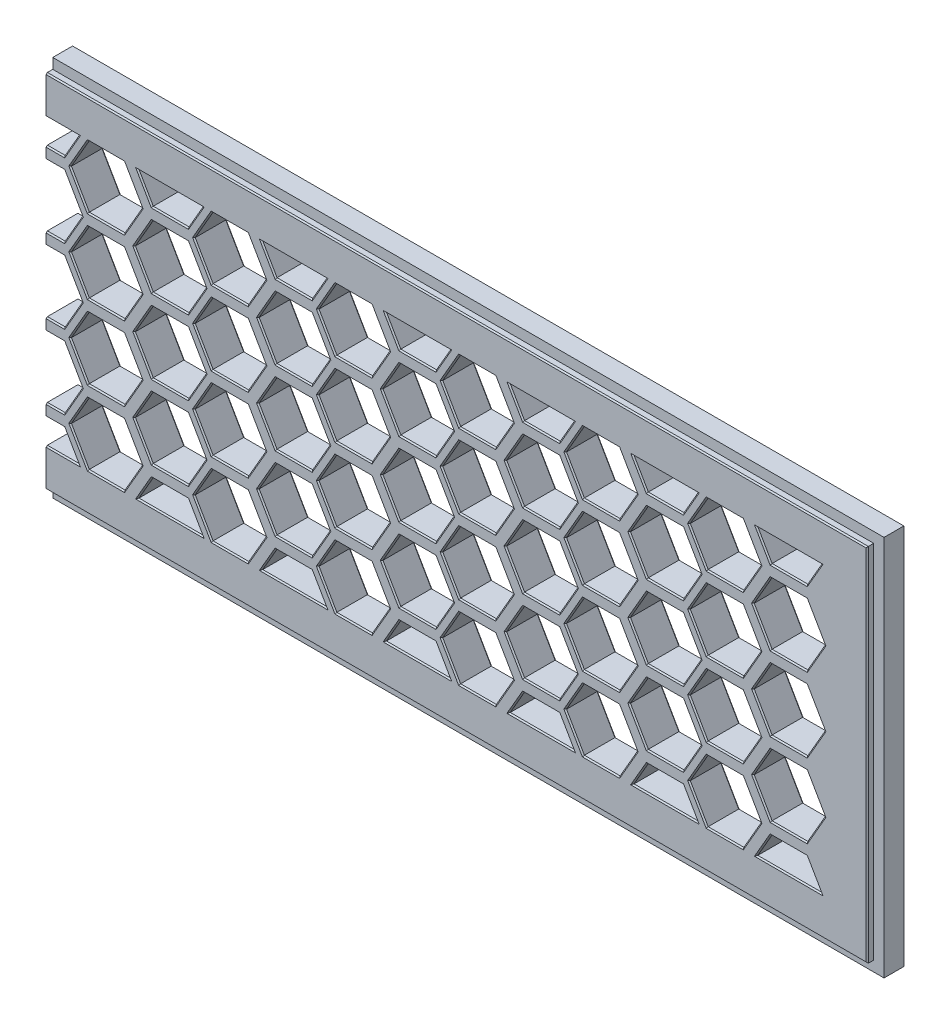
SolidWorks part; units mm, degrees
ref_plane "Aufriss" through (0, 0, 0) normal (0, 0, 1) x (1, 0, 0)
ref_plane "Grundriss" through (0, 0, 0) normal (0, 1, 0) x (1, 0, 0)
ref_plane "Seitenriss" through (0, 0, 0) normal (1, 0, 0) x (0, 0, -1)
sketch "Skizze1" plane through (0, 0, 0) normal (0, 0, 1) x (1, 0, 0)
  line L1 (-192, -43.75) -> (192, -43.75)
  line L2 (-192, -43.75) -> (-192, 43.75)
  line L3 (-192, 43.75) -> (192, 43.75)
  line L4 (192, -43.75) -> (192, 43.75)
  line L5 (-192, -43.75) -> (192, 43.75) construction
  line L6 (-192, 43.75) -> (192, -43.75) construction
  point P0 (0, 0)
  dimension "D1" = 384
  dimension "D2" = 87.5
extrude "Aufsatz-Linear austragen1" add sketch "Skizze1" along normal mid plane 8
sketch "Skizze2" plane through (0, 0, 4) normal (0, 0, 1) x (1, 0, 0)
  line L0 (-192, 43.75) -> (-192, -43.75) construction
  line L1 (-168.1699, 34.5) -> (-176.8301, 34.5)
  line L2 (-176.8301, 34.5) -> (-181.1603, 27)
  line L3 (-181.1603, 27) -> (-176.8301, 19.5)
  line L4 (-176.8301, 19.5) -> (-168.1699, 19.5)
  line L5 (-168.1699, 19.5) -> (-163.8397, 27)
  line L6 (-163.8397, 27) -> (-168.1699, 34.5)
  line L7 (192, 43.75) -> (-192, 43.75) construction
  circle A0 centre (-172.5, 27) radius 7.5 construction
  dimension "D1" = 19.5
  dimension "D2" = 16.75
  dimension "D3" = 15
extrude "Schnitt-Linear austragen1" cut sketch "Skizze2" against normal through all
pattern_linear "Lineares Muster1" count 12 spacing 30 along (1, 0, 0) count 4 spacing 18 along (0, -1, 0) of "Schnitt-Linear austragen1"
sketch "Skizze3" plane through (0, 0, 4) normal (0, 0, 1) x (1, 0, 0)
  line L0 (-168.1699, 34.5) -> (-176.8301, 34.5) construction
  line L1 (-161.3301, 25.5) -> (-165.6603, 18)
  line L2 (-165.6603, 18) -> (-161.3301, 10.5)
  line L3 (-161.3301, 10.5) -> (-152.6699, 10.5)
  line L4 (-152.6699, 10.5) -> (-148.3397, 18)
  line L5 (-148.3397, 18) -> (-152.6699, 25.5)
  line L6 (-152.6699, 25.5) -> (-161.3301, 25.5)
  line L7 (-192, 43.75) -> (-192, -43.75) construction
  line L8 (192, 43.75) -> (-192, 43.75) construction
  circle A0 centre (-157, 18) radius 7.5 construction
  dimension "D1" = 35
  dimension "D2" = 25.75
extrude "Schnitt-Linear austragen2" cut sketch "Skizze3" against normal through all
pattern_linear "Lineares Muster2" count 12 spacing 30 along (1, 0, 0) count 4 spacing 18 along (0, -1, 0) of "Schnitt-Linear austragen2"
pattern_linear "Lineares Muster3" count 2 spacing 18 along (0, 1, 0) count 25 spacing 30 along (1, 0, 0) of "Schnitt-Linear austragen2"
sketch "Skizze4" plane through (0, 0, 4) normal (0, 0, 1) x (1, 0, 0)
  line L0 (192, -43.75) -> (192, 43.75) construction
  line L1 (-192, 43.75) -> (192, 43.75)
  line L3 (-192, 34.5) -> (192, 34.5)
  line L4 (192, 43.75) -> (192, 34.5)
  line L5 (-192, 43.75) -> (-192, -43.75) construction
  line L6 (192, -43.75) -> (-192, -43.75)
  line L7 (192, -43.75) -> (192, -34.5)
  line L8 (192, -34.5) -> (-192, -34.5)
  line L9 (-192, -43.75) -> (-192, -34.5)
  line L11 (-176.8301, -34.5) -> (-168.1699, -34.5) construction
  line L12 (-168.1699, 34.5) -> (-176.8301, 34.5) construction
  line L14 (-192, 34.5) -> (-192, 43.75)
extrude "Aufsatz-Linear austragen2" add sketch "Skizze4" against normal up to surface (8 mm away)
sketch "Skizze5" plane through (0, 0, 0) normal (0, 0, 1) x (1, 0, 0)
  line L1 (-192, 43.75) -> (192, 43.75)
  line L2 (-192, 43.75) -> (-192, -43.75)
  line L3 (-192, -43.75) -> (192, -43.75)
  line L4 (192, 43.75) -> (192, -43.75)
  line L5 (-194.5, 46.25) -> (194.5, 46.25)
  line L6 (-194.5, 46.25) -> (-194.5, -46.25)
  line L7 (-194.5, -46.25) -> (194.5, -46.25)
  line L8 (194.5, 46.25) -> (194.5, -46.25)
  dimension "D1" = 2.5
  dimension "D2" = 2.5
  dimension "D3" = 2.5
  dimension "D4" = 2.5
extrude "Aufsatz-Linear austragen3" add sketch "Skizze5" along normal mid plane 4.8
sketch "Skizze6" plane through (0, 0, 4) normal (0, 0, 1) x (1, 0, 0)
  line L0 (194.5, 46.25) -> (-194.5, 46.25) construction
  line L1 (67.5, -46.25) -> (194.5, -46.25)
  line L2 (67.5, -46.25) -> (67.5, 46.25)
  line L3 (67.5, 46.25) -> (194.5, 46.25)
  line L4 (194.5, -46.25) -> (194.5, 46.25)
  line L8 (71.8301, 34.5) -> (63.1699, 34.5) construction
  point P0 (0, 0)
  point P10 (67.5, 34.5)
chamfer "Fase1" distance 0.3 angle 45
sketch "Skizze8" plane through (0, 0, 4) normal (0, 0, 1) x (1, 0, 0)
  line L0 (-194.5, -46.25) -> (194.5, -46.25) construction
  line L1 (-194.5, 46.25) -> (-7, 46.25)
  line L2 (-194.5, 46.25) -> (-194.5, -46.25)
  line L3 (-194.5, -46.25) -> (-7, -46.25)
  line L4 (-7, 46.25) -> (-7, -46.25)
  line L5 (-11.5033, 25.8) -> (-2.4967, 25.8) construction
  point P9 (-7, 25.8)
extrude "Schnitt-Linear austragen4" cut sketch "Skizze8" against normal through all
